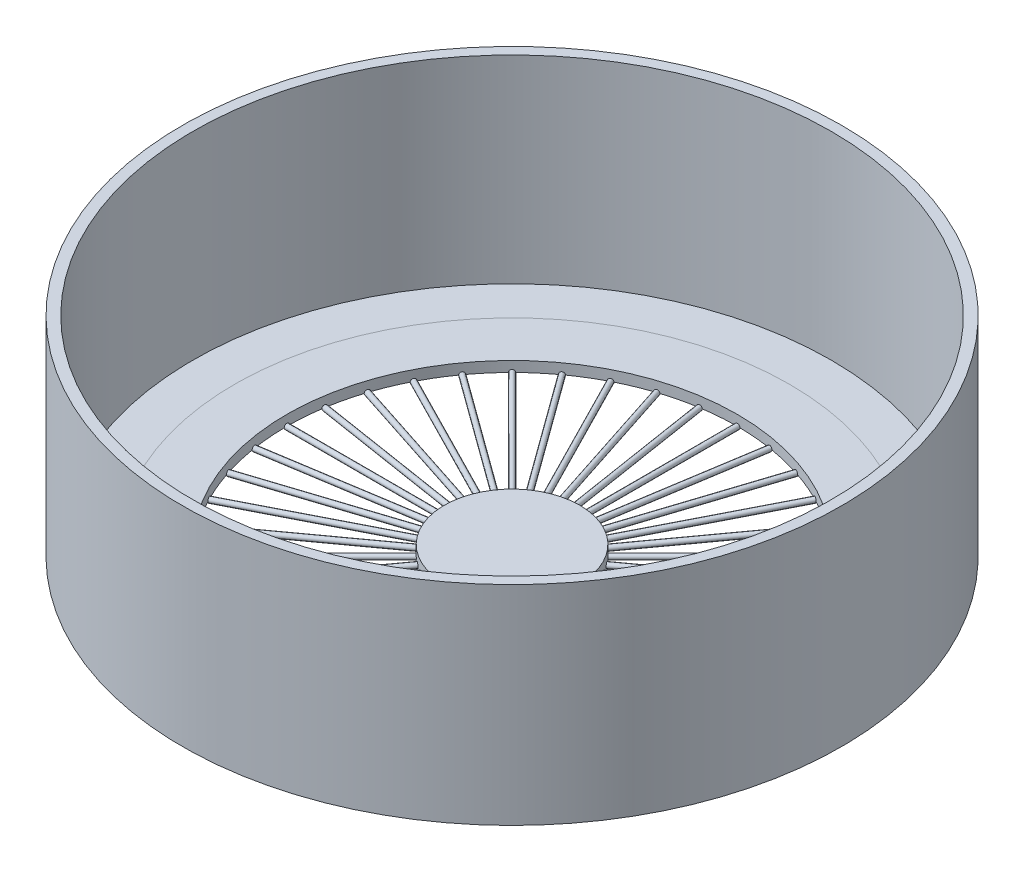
SolidWorks part; units mm, degrees
ref_plane "Front Plane" through (0, 0, 0) normal (0, 0, 1) x (1, 0, 0)
ref_plane "Top Plane" through (0, 0, 0) normal (0, 1, 0) x (1, 0, 0)
ref_plane "Right Plane" through (0, 0, 0) normal (1, 0, 0) x (0, 0, -1)
sketch "Sketch1" plane through (0, 0, 0) normal (0, 0, 1) x (1, 0, 0)
  line L0 (266, 0) -> (316, 0.0391)
  line L1 (316, 0.0391) -> (316, 200.0391)
  line L2 (266, 0) -> (216, 0)
  line L3 (306, 10.0313) -> (306, 200.0391)
  line L4 (265.9961, 10) -> (306, 10.0313)
  line L5 (265.9961, 10) -> (216, 10)
  line L6 (216, 10) -> (216, 0)
  line L7 (316, 200.0391) -> (306, 200.0391)
  line L8 (0, 0) -> (0, 92.0741) construction
  dimension "D1" = 200
  dimension "D2" = 50
  dimension "D3" = 316
  dimension "D4" = 50
  dimension "D5" = 10
revolve "Revolve1" add sketch "Sketch1" angle 360 about L8
sketch "Sketch2" plane through (0, 0, 0) normal (0, -1, 0) x (-1, 0, 0)
  line L0 (0, -216) -> (0, 216)
  line L1 (40, -212.264) -> (40, 212.264)
  line L2 (80, -200.639) -> (80, 200.639)
  line L3 (120, -179.5996) -> (120, 179.5996)
  line L4 (150, -155.422) -> (150, 155.422)
  line L5 (-40, -212.264) -> (-40, 212.264)
  line L6 (-80, -200.639) -> (-80, 200.639)
  line L7 (-120, -179.5996) -> (-120, 179.5996)
  line L8 (-150, -155.422) -> (-150, 155.422)
  line L9 (40, -212.264) -> (-40, -212.264)
  line L10 (80, -200.639) -> (-80, -200.639)
  line L11 (120, -179.5996) -> (-120, -179.5996)
  line L12 (-150, -155.422) -> (150, -155.422)
  line L13 (0, 0) -> (57.3912, 0) construction
  line L14 (40, 212.264) -> (-40, 212.264)
  line L15 (80, 200.639) -> (-80, 200.639)
  line L16 (120, 179.5996) -> (-120, 179.5996)
  line L17 (-150, 155.422) -> (150, 155.422)
  line L19 (216, 0) -> (-216, 0)
  circle A0 centre (0, 0) radius 216 construction
  dimension "D1" = 40
  dimension "D2" = 40
  dimension "D3" = 40
  dimension "D4" = 30
sweep "Sweep1" add path "Sketch2" parameters "D3"=5
pattern_circular "CirPattern1" count 40 over 360 about axis through (0, 0, 0) along (0, 1, 0) of "Sweep1"
sketch "Sketch46" plane through (0, 0, 0) normal (0, -1, 0) x (1, 0, 0)
  circle A1 centre (0, 0) radius 65
  dimension "D1" = 130
extrude "Boss-Extrude1" add sketch "Sketch46" against normal blind 10
sketch "Sketch47" plane through (0, 0, 0) normal (0, -1, 0) x (1, 0, 0)
  circle A0 centre (0, 0) radius 65
extrude "Boss-Extrude2" add sketch "Sketch47" along normal blind 10
